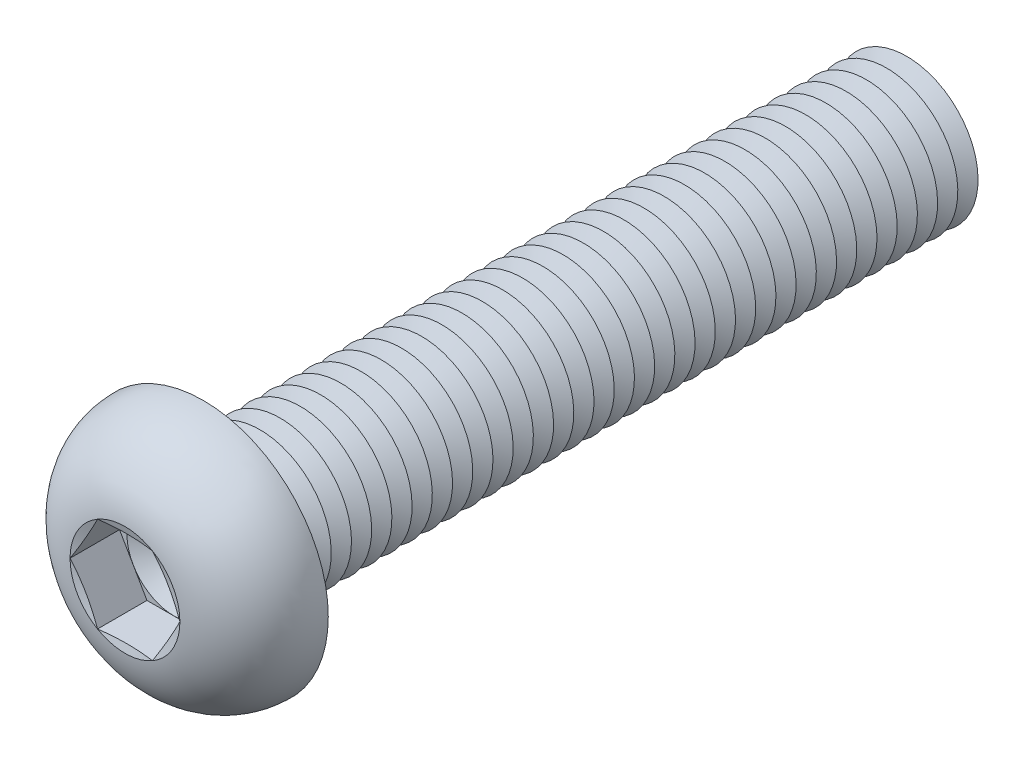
SolidWorks part; units mm, degrees
ref_plane "Front Plane" through (0, 0, 0) normal (0, 0, 1) x (1, 0, 0)
ref_plane "Top Plane" through (0, 0, 0) normal (0, 1, 0) x (1, 0, 0)
ref_plane "Right Plane" through (0, 0, 0) normal (1, 0, 0) x (0, 0, -1)
sketch "Sketch1" plane through (0, 0, 0) normal (1, 0, 0) x (0, 0, -1)
  line L0 (0, 6) -> (0, 10.5)
  line L3 (0, 6) -> (60, 6)
  line L4 (60, 6) -> (60, 0)
  line L5 (60, 0) -> (-6.6, 0) construction
  line L6 (-6.6, 0) -> (60, 0)
  line L7 (-6.6, 4.6188) -> (-6.6, 2.3094) construction
  line L8 (-6.6, 2.3094) -> (-6.6, 0)
  line L9 (-6.6, 4.6188) -> (-5.9812, 2.3094)
  line L10 (-5.9812, 2.3094) -> (-6.6, 2.3094)
  line L11 (60, 0) -> (22.7481, 0) construction
  line L12 (0, 10.5) -> (-6.6, 10.5) construction
  arc A1 (0, 10.5) -> (-6.6, 4.6188) centre (0, 3.8561) ccw
  point P8 (60, 3)
  dimension "D1" = 21
  dimension "D2" = 12
  dimension "D3" = 6.6
  dimension "D4" = 9.2376
  dimension "D5" = 60
  dimension "D6" = 15
revolve "Revolve1" add sketch "Sketch1" angle 360 about L5
fillet "Fillet1" radius 0.85 1 edges at (0, 6, 0)
sketch "Sketch2" plane through (0, 0, 0) normal (1, 0, 0) x (0, 0, -1)
  line L0 (59.15, 6) -> (60.85, 6)
  line L1 (60, 6) -> (0.85, 6) construction
  line L2 (60.85, 6) -> (60, 4.5278)
  line L3 (60, -6) -> (60, 6) construction
  line L4 (60, 4.5278) -> (59.15, 6)
  dimension "D1" = 1.7
revolve "Cut-Revolve1" cut sketch "Sketch2" angle 360 about axis through (0, 0, -60) along (0, 0, -1)
pattern_linear "LPattern1" count 35 spacing 1.7 along (0, 0, 1) of "Cut-Revolve1"
sketch "Sketch3" plane through (0, 0, 6.6) normal (0, 0, 1) x (1, 0, 0)
  line L7 (2.3094, 4) -> (-2.3094, 4)
  line L8 (-2.3094, 4) -> (-4.6188, 0)
  line L9 (-4.6188, 0) -> (-2.3094, -4)
  line L10 (-2.3094, -4) -> (2.3094, -4)
  line L11 (2.3094, -4) -> (4.6188, 0)
  line L12 (4.6188, 0) -> (2.3094, 4)
  circle A0 centre (0, 0) radius 4 construction
  circle A3 centre (0, 0) radius 4.6188 construction
extrude "Cut-Extrude1" cut sketch "Sketch3" against normal blind 4.16
sketch "Sketch4" plane through (0, 0, 2.44) normal (0, 0, 1) x (1, 0, 0)
  line L1 (2.3094, 4) -> (-2.3094, 4) construction
  circle A0 centre (0, 0) radius 4
extrude "Cut-Extrude2" cut sketch "Sketch4" against normal through all draft 60
